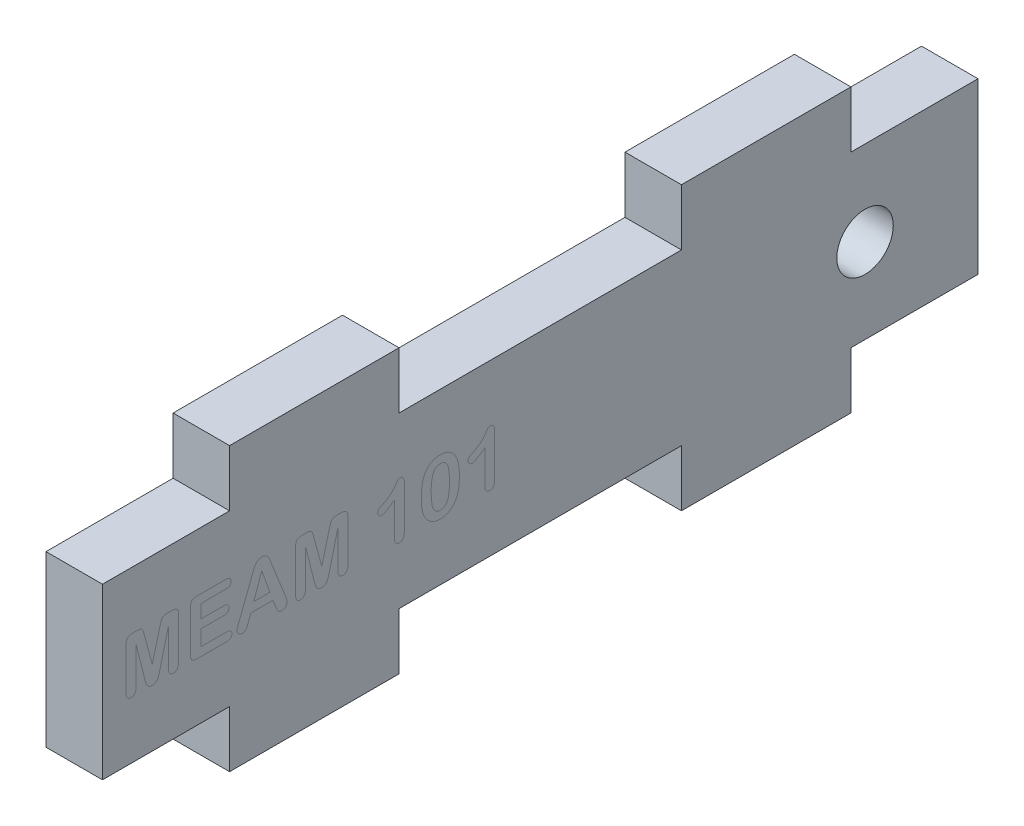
SolidWorks part; units mm, degrees
ref_plane "Front Plane" through (0, 0, 0) normal (0, 0, 1) x (1, 0, 0)
ref_plane "Top Plane" through (0, 0, 0) normal (0, 1, 0) x (1, 0, 0)
ref_plane "Right Plane" through (0, 0, 0) normal (1, 0, 0) x (0, 0, -1)
sketch "Sketch1" plane through (0, 0, 0) normal (1, 0, 0) x (0, 0, -1)
  line L1 (-49.2125, 9.525) -> (49.2125, 9.525)
  line L2 (-49.2125, 9.525) -> (-49.2125, -9.525)
  line L3 (-49.2125, -9.525) -> (49.2125, -9.525)
  line L4 (49.2125, 9.525) -> (49.2125, -9.525)
  line L5 (-49.2125, 9.525) -> (49.2125, -9.525) construction
  line L6 (-49.2125, -9.525) -> (49.2125, 9.525) construction
  point P0 (0, 0)
  dimension "D1" = 19.05
  dimension "D2" = 98.425
extrude "Boss-Extrude1" add sketch "Sketch1" along normal mid plane 6.35 contours L1 L4 L3 L2
sketch "Sketch2" plane through (3.175, 0, 0) normal (1, 0, 0) x (0, 0, -1)
  line L0 (-49.2125, 9.525) -> (49.2125, 9.525) construction
  line L1 (-34.925, 9.525) -> (-15.875, 9.525)
  line L2 (-34.925, 9.525) -> (-34.925, 15.875)
  line L3 (-34.925, 15.875) -> (-15.875, 15.875)
  line L4 (-15.875, 9.525) -> (-15.875, 15.875)
  line L5 (-15.875, 9.525) -> (15.875, 9.525) construction
  line L6 (15.875, 9.525) -> (34.925, 9.525)
  line L7 (15.875, 9.525) -> (15.875, 15.875)
  line L8 (15.875, 15.875) -> (34.925, 15.875)
  line L9 (34.925, 9.525) -> (34.925, 15.875)
  line L10 (0, 0) -> (0, 9.525) construction
  dimension "D1" = 19.05
  dimension "D2" = 50.8
  dimension "D3" = 6.35
extrude "Boss-Extrude2" add sketch "Sketch2" against normal up to surface (6.35 mm away)
mirror "Mirror1" about plane through (0, 0, 0) normal (0, 1, 0) of "Boss-Extrude2"
sketch "Sketch3" plane through (3.175, 0, 0) normal (1, 0, 0) x (0, 0, -1)
  line L0 (0, 0) -> (36.5125, 0) construction
  line L1 (49.2125, 9.525) -> (49.2125, -9.525) construction
  circle A0 centre (36.5125, 0) radius 3.175
  dimension "D1" = 6.35
  dimension "D2" = 12.7
extrude "Cut-Extrude1" cut sketch "Sketch3" against normal up to surface (6.35 mm away)
sketch "Sketch4" plane through (3.175, 0, 0) normal (1, 0, 0) x (0, 0, -1)
  line L0 (-49.2125, -3.048) -> (-1.5875, -3.048) construction
  line L1 (-49.2125, 9.525) -> (-49.2125, -9.525) construction
  circle A0 centre (36.5125, 0) radius 3.175 construction
  text T0 "MEAM 101" font "Arial Rounded MT Bold" height 6.35
  dimension "D1" = 3.048
  dimension "D2" = 38.1
sketch "Laser" plane through (3.175, 0, 0) normal (1, 0, 0) x (0, 0, -1)
  line L40 (-49.3141, 9.6266) -> (-49.3141, -9.6266)
  line L41 (-49.3141, -9.6266) -> (-35.0266, -9.6266)
  line L42 (-35.0266, -9.6266) -> (-35.0266, -15.9766)
  line L43 (-35.0266, -15.9766) -> (-15.7734, -15.9766)
  line L44 (-15.7734, -15.9766) -> (-15.7734, -9.6266)
  line L45 (-15.7734, -9.6266) -> (15.7734, -9.6266)
  line L46 (15.7734, -9.6266) -> (15.7734, -15.9766)
  line L47 (15.7734, -15.9766) -> (35.0266, -15.9766)
  line L48 (35.0266, -15.9766) -> (35.0266, -9.6266)
  line L49 (35.0266, -9.6266) -> (49.3141, -9.6266)
  line L50 (49.3141, -9.6266) -> (49.3141, 9.6266)
  line L51 (49.3141, 9.6266) -> (35.0266, 9.6266)
  line L52 (35.0266, 9.6266) -> (35.0266, 15.9766)
  line L53 (35.0266, 15.9766) -> (15.7734, 15.9766)
  line L54 (15.7734, 15.9766) -> (15.7734, 9.6266)
  line L55 (15.7734, 9.6266) -> (-15.7734, 9.6266)
  line L56 (-15.7734, 9.6266) -> (-15.7734, 15.9766)
  line L57 (-15.7734, 15.9766) -> (-35.0266, 15.9766)
  line L58 (-35.0266, 15.9766) -> (-35.0266, 9.6266)
  line L59 (-35.0266, 9.6266) -> (-49.3141, 9.6266)
  line L60 (-49.3141, 9.6266) -> (-49.3141, -9.6266)
  line L61 (-49.3141, -9.6266) -> (-35.0266, -9.6266)
  line L62 (-35.0266, -9.6266) -> (-35.0266, -15.9766)
  line L63 (-35.0266, -15.9766) -> (-15.7734, -15.9766)
  line L64 (-15.7734, -15.9766) -> (-15.7734, -9.6266)
  line L65 (-15.7734, -9.6266) -> (15.7734, -9.6266)
  line L66 (15.7734, -9.6266) -> (15.7734, -15.9766)
  line L67 (15.7734, -15.9766) -> (35.0266, -15.9766)
  line L68 (35.0266, -15.9766) -> (35.0266, -9.6266)
  line L69 (35.0266, -9.6266) -> (49.3141, -9.6266)
  line L70 (49.3141, -9.6266) -> (49.3141, 9.6266)
  line L71 (49.3141, 9.6266) -> (35.0266, 9.6266)
  line L72 (35.0266, 9.6266) -> (35.0266, 15.9766)
  line L73 (35.0266, 15.9766) -> (15.7734, 15.9766)
  line L74 (15.7734, 15.9766) -> (15.7734, 9.6266)
  line L75 (15.7734, 9.6266) -> (-15.7734, 9.6266)
  line L76 (-15.7734, 9.6266) -> (-15.7734, 15.9766)
  line L77 (-15.7734, 15.9766) -> (-35.0266, 15.9766)
  line L78 (-35.0266, 15.9766) -> (-35.0266, 9.6266)
  line L79 (-35.0266, 9.6266) -> (-49.3141, 9.6266)
  circle A2 centre (36.5125, 0) radius 2.921
  circle A3 centre (36.5125, 0) radius 2.921
  dimension "D1" = 0.1016
  dimension "D2" = 0.254
